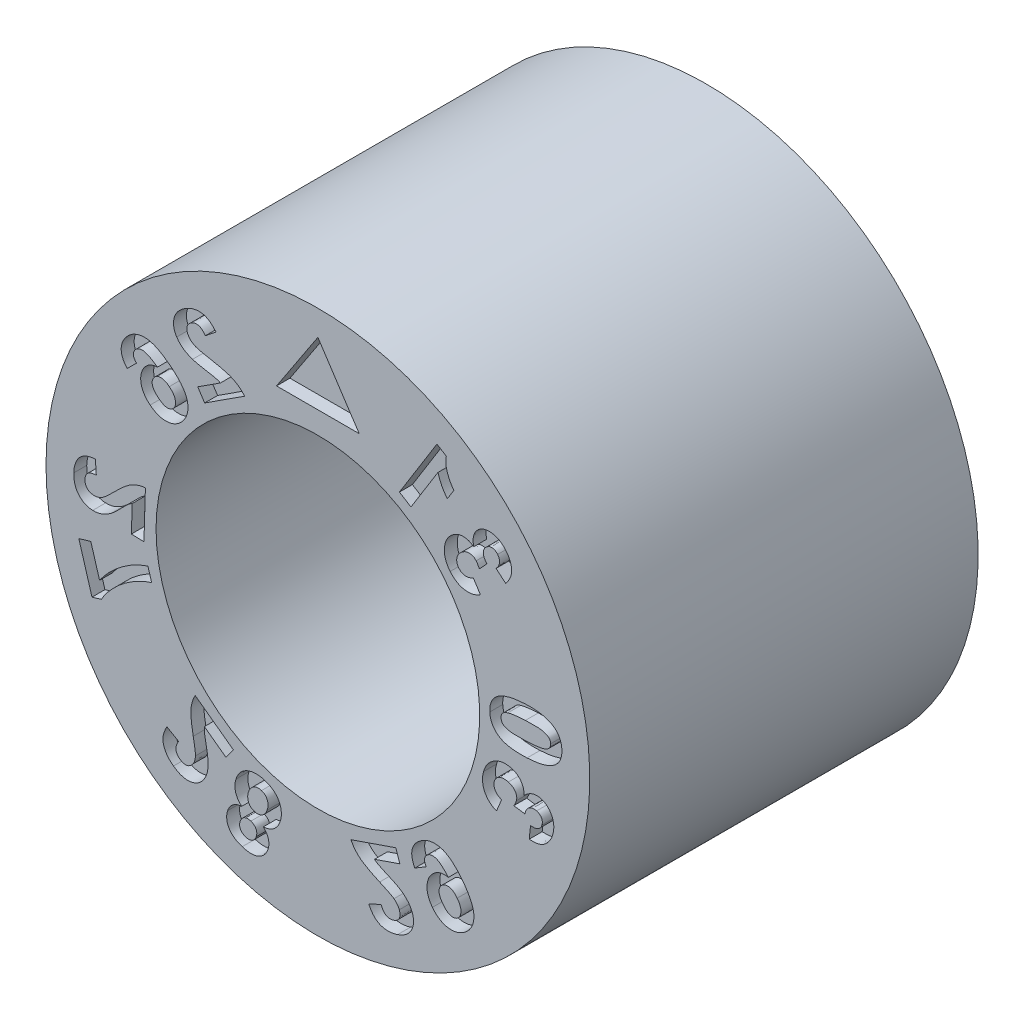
SolidWorks part; units mm, degrees
ref_plane "Front Plane" through (0, 0, 0) normal (0, 0, 1) x (1, 0, 0)
ref_plane "Top Plane" through (0, 0, 0) normal (0, 1, 0) x (1, 0, 0)
ref_plane "Right Plane" through (0, 0, 0) normal (1, 0, 0) x (0, 0, -1)
imported_body "Imported1"
other "DeleteFace1"
other "Move Face1" parameters "D1"=0.11
sketch "Sketch1" plane through (0, 0, 0) normal (0, 0, 1) x (1, 0, 0)
  line L0 (0, 0) -> (0, -2.7629) construction
  line L1 (0, 0) -> (-2.461, 1.4208) construction
  line L2 (0, 0) -> (2.4143, 1.3939) construction
  line L3 (0, 0) -> (2.7175, -1.569) construction
  line L4 (0, 0) -> (-2.7175, -1.569) construction
  line L5 (0, -1.65) -> (0, 1.65) construction
  arc A0 (-0.5502, 1.2383) -> (0.5768, 1.2261) centre (0, 0) ccw construction
  text T2 "26  27  28  29  30  31" font "Arial" height 0.55
  dimension "D1" = 2.71
  dimension "D2" = 60
  dimension "D3" = 60
extrude "Cut-Extrude1" cut sketch "Sketch1" against normal blind 0.1
